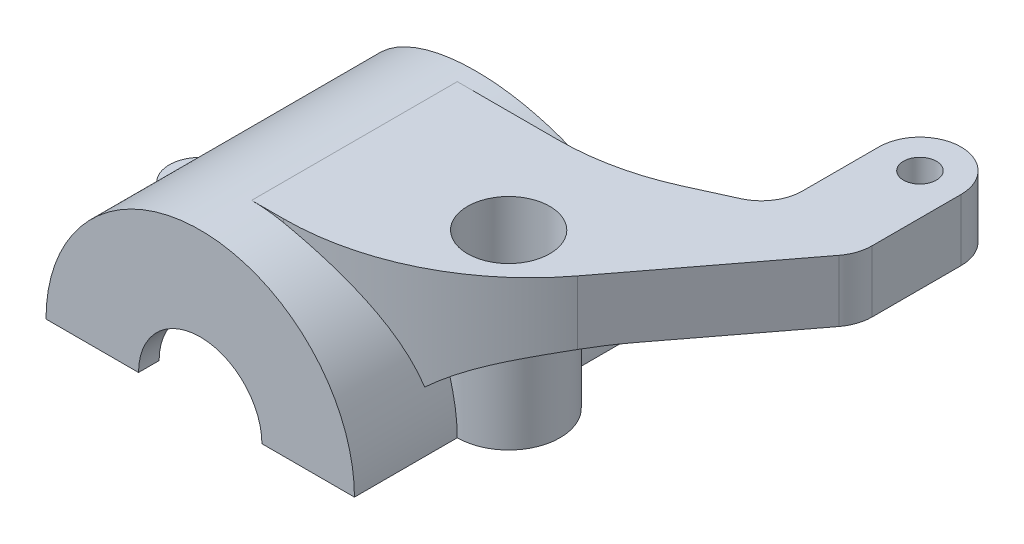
SolidWorks part; units mm, degrees
ref_plane "Front Plane" through (0, 0, 0) normal (0, 0, 1) x (1, 0, 0)
ref_plane "Top Plane" through (0, 0, 0) normal (0, 1, 0) x (1, 0, 0)
ref_plane "Right Plane" through (0, 0, 0) normal (1, 0, 0) x (0, 0, -1)
sketch "Sketch1" plane through (0, 0, 0) normal (0, 0, 1) x (1, 0, 0)
  circle A0 centre (0, 0) radius 9.525
  dimension "D1" = 19.05
extrude "Boss-Extrude1" add sketch "Sketch1" along normal blind 31.75
sketch "Sketch2" plane through (0, 0, 0) normal (0, 1, 0) x (1, 0, 0)
  line L0 (9.525, 0) -> (-9.525, 0) construction
  circle A0 centre (0, -6.35) radius 6.35
  dimension "D1" = 12.7
  dimension "D2" = 6.35
extrude "Boss-Extrude3" add sketch "Sketch2" along normal mid plane 19.05
sketch "Sketch3" plane through (0, 0, 0) normal (0, 1, 0) x (1, 0, 0)
  line L0 (-6.35, -6.35) -> (-9.525, -12.7)
  line L1 (-9.525, 0) -> (-9.525, -31.75) construction
  line L2 (-9.525, -12.7) -> (-12.728, -12.7)
  line L3 (-12.728, -12.7) -> (-12.728, 2.5774)
  line L4 (-12.728, 2.5774) -> (12.728, 2.5774)
  line L5 (12.728, 2.5774) -> (12.728, -12.7)
  line L6 (12.728, -12.7) -> (9.4319, -12.7)
  line L8 (6.35, -6.35) -> (9.4319, -12.7)
  arc A1 (6.35, -6.35) -> (-6.35, -6.35) centre (0, -6.35) ccw
extrude "Cut-Extrude1" cut sketch "Sketch3" against normal mid plane 19.05
sketch "Sketch17" plane through (0, 0, 0) normal (0, 1, 0) x (1, 0, 0)
  circle A0 centre (0, -6.35) radius 6.35
extrude "Boss-Extrude5" add sketch "Sketch17" against normal blind 10.16
sketch "Sketch18" plane through (0, 0, 0) normal (1, 0, 0) x (0, 0, -1)
  line L0 (-12.7, -10.16) -> (0, -10.16) construction
  line L1 (0.619, 11.9651) -> (-12.6697, 11.9651)
  line L2 (0.619, 11.9651) -> (0.619, 2.54)
  line L3 (0.619, 2.54) -> (-12.7, 2.54)
  line L5 (-12.7, 2.54) -> (-14.732, 9.525)
  line L6 (-12.7, 9.525) -> (-31.75, 9.525) construction
  line L7 (-14.732, 9.525) -> (-14.732, 11.9651)
  line L8 (-14.732, 11.9651) -> (-12.6697, 11.9651)
  dimension "D1" = 12.7
  dimension "D2" = 2.032
  dimension "D3" = 12.7
extrude "Cut-Extrude9" cut sketch "Sketch18" against normal through all both and the other way through all
sketch "Sketch19" plane through (0, -10.16, 0) normal (0, -1, 0) x (1, 0, 0)
  circle A0 centre (0, 6.35) radius 2.54
  dimension "D1" = 5.08
extrude "Cut-Extrude10" cut sketch "Sketch19" against normal through all
sketch "Sketch20" plane through (0, 0, 0) normal (1, 0, 0) x (0, 0, -1)
  line L0 (-32.7805, 0) -> (-32.7805, -11.6042)
  line L1 (-32.7805, 0) -> (-12.7, 0)
  line L4 (-12.7, 0) -> (-12.7, 4.1218)
  line L5 (-32.7805, -11.6042) -> (2.1772, -11.6042)
  line L6 (2.1772, -11.6042) -> (2.1772, 4.1218)
  line L7 (2.1772, 4.1218) -> (-12.7, 4.1218)
extrude "Cut-Extrude11" cut sketch "Sketch20" against normal through all both and the other way through all
sketch "Sketch21" plane through (0, 0, 0) normal (0, -1, 0) x (1, 0, 0)
  line L0 (3.81, 31.75) -> (3.81, 30.48)
  line L1 (9.525, 31.75) -> (-9.525, 31.75) construction
  line L2 (3.81, 30.48) -> (7.9375, 30.48)
  line L3 (7.9375, 30.48) -> (7.9375, 25.4)
  line L4 (7.9375, 25.4) -> (6.35, 25.4)
  line L5 (6.35, 25.4) -> (6.35, 15.24)
  line L6 (6.35, 15.24) -> (0, 15.24)
  line L7 (0, 33.6612) -> (0, 5.9676) construction
  line L8 (3.81, 31.75) -> (0, 31.75)
  line L9 (0, 15.24) -> (0, 31.75)
  dimension "D1" = 3.81
  dimension "D2" = 7.9375
  dimension "D3" = 6.35
  dimension "D4" = 5.08
  dimension "D5" = 10.16
  dimension "D6" = 1.27
sketch "Sketch22" plane through (0, 0, 0) normal (0, 1, 0) x (1, 0, 0)
  line L0 (9.525, -22.225) -> (19.05, -12.7) construction
  line L1 (9.525, -12.7) -> (9.525, -31.75) construction
  line L2 (19.05, -12.7) -> (19.05, 0) construction
  line L3 (0, 0) -> (0, -6.35) construction
  line L4 (16.51, -6.35) -> (16.51, -11.0645)
  line L5 (15.0211, -13.3768) -> (9.525, -15.875)
  line L6 (21.59, -6.35) -> (21.59, -11.8443)
  line L7 (21.0723, -13.3812) -> (9.525, -28.575)
  line L12 (-9.1801, -12.7) -> (9.1801, -12.7) construction
  line L13 (0, 0) -> (0, -40.5865) construction
  line L14 (-21.59, -6.35) -> (-21.59, -11.8443)
  line L15 (-16.51, -6.35) -> (-16.51, -11.0645)
  line L16 (-15.0211, -13.3768) -> (-9.525, -15.875)
  line L17 (-21.0723, -13.3812) -> (-9.525, -28.575)
  line L18 (-9.525, -15.875) -> (9.525, -15.875)
  line L19 (-9.525, -28.575) -> (9.525, -28.575)
  arc A0 (21.59, -6.35) -> (16.51, -6.35) centre (19.05, -6.35) ccw
  arc A1 (-21.59, -6.35) -> (-16.51, -6.35) centre (-19.05, -6.35) cw
  arc A2 (21.59, -11.8443) -> (21.0723, -13.3812) centre (19.05, -11.8443) cw
  arc A3 (16.51, -11.0645) -> (15.0211, -13.3768) centre (13.97, -11.0645) cw
  arc A4 (-21.59, -11.8443) -> (-21.0723, -13.3812) centre (-19.05, -11.8443) ccw
  arc A5 (-16.51, -11.0645) -> (-15.0211, -13.3768) centre (-13.97, -11.0645) ccw
  point P27 (21.59, -12.7)
  point P30 (16.51, -12.7)
  point P33 (-21.59, -12.7)
  point P36 (-16.51, -12.7)
  dimension "D5" = 5.08
  dimension "D7" = 2.54
  dimension "D1" = 6.35
  dimension "D2" = 12.7
  dimension "D3" = 6.35
  dimension "D4" = 19.05
  dimension "D6" = 6.35
extrude "Boss-Extrude6" add sketch "Sketch22" along normal blind 9.525
revolve "Cut-Revolve2" cut sketch "Sketch21" angle 360 about L7
sketch "Sketch23" plane through (0, 0, 28.575) normal (0, 0, 1) x (1, 0, 0)
  line L0 (-6.35, 0) -> (6.35, 0) construction
  line L1 (0, 9.525) -> (0, 16.1312)
  line L2 (0, 16.1312) -> (-24.1946, 16.1312)
  line L3 (-24.1946, 16.1312) -> (-24.1946, -2.1819)
  line L4 (-24.1946, -2.1819) -> (-9.525, -2.1819)
  line L5 (-9.525, -2.1819) -> (-9.525, 0)
  arc A0 (0, 9.525) -> (-9.525, 0) centre (0, 0) ccw
extrude "Cut-Extrude12" cut sketch "Sketch23" against normal through all
sketch "Sketch24" plane through (0, 0, 28.575) normal (0, 0, 1) x (1, 0, 0)
  line L0 (25.2639, 5.715) -> (11.5203, 5.715)
  line L1 (11.5203, 5.715) -> (8.9803, 3.175)
  line L2 (9.525, 0) -> (12.9661, -7.8852)
  line L3 (12.9661, -7.8852) -> (25.2639, -7.8852)
  line L4 (25.2639, -7.8852) -> (25.2639, 5.715)
  line L5 (9.525, 9.525) -> (21.0723, 9.525) construction
  arc A0 (9.525, 0) -> (-9.525, 0) centre (0, 0) ccw construction
  arc A1 (9.525, 0) -> (8.9803, 3.175) centre (0, 0) ccw
  dimension "D1" = 3.81
  dimension "D2" = 2.54
  dimension "D3" = 2.54
extrude "Cut-Extrude13" cut sketch "Sketch24" against normal through all
fillet "Fillet1" radius 15.24 2 edges at (9.525, 6.6224, 15.875) (9.525, 6.6224, 28.575)
fillet "Fillet2" radius 10.16 1 edges at (11.5203, 5.715, 20.0665)
sketch "Sketch25" plane through (0, 0, 0) normal (0, -1, 0) x (1, 0, 0)
  line L0 (9.525, 12.7) -> (9.525, 31.75) construction
  circle A0 centre (9.525, 22.225) radius 3.175
  dimension "D1" = 6.35
extrude "Boss-Extrude7" add sketch "Sketch25" against normal through all
sketch "Sketch26" plane through (0, 0, 0) normal (0, -1, 0) x (1, 0, 0)
  line L0 (-9.525, 12.7) -> (-9.525, 31.75) construction
  circle A0 centre (-9.525, 22.225) radius 1.905
  dimension "D1" = 3.81
extrude "Boss-Extrude8" add sketch "Sketch26" against normal blind 2.54
sketch "Sketch27" plane through (0, 2.54, 0) normal (0, 1, 0) x (1, 0, 0)
  circle A1 centre (-9.525, -22.225) radius 2.54
  dimension "D1" = 5.08
extrude "Cut-Extrude14" cut sketch "Sketch27" along normal through all
sketch "Sketch28" plane through (0, 0, 0) normal (0, -1, 0) x (1, 0, 0)
  circle A0 centre (-9.525, 22.225) radius 1.143
  circle A1 centre (9.525, 22.225) radius 1.143
  circle A2 centre (19.05, 6.35) radius 1.016
  dimension "D1" = 2.032
  dimension "D2" = 2.286
  dimension "D3" = 2.286
extrude "Cut-Extrude15" cut sketch "Sketch28" against normal through all
sketch "Sketch29" plane through (0, 9.525, 0) normal (0, 1, 0) x (1, 0, 0)
  circle A0 centre (9.525, -22.225) radius 2.54
  dimension "D1" = 5.08
extrude "Cut-Extrude16" cut sketch "Sketch29" against normal up to surface (6.985 mm away)
